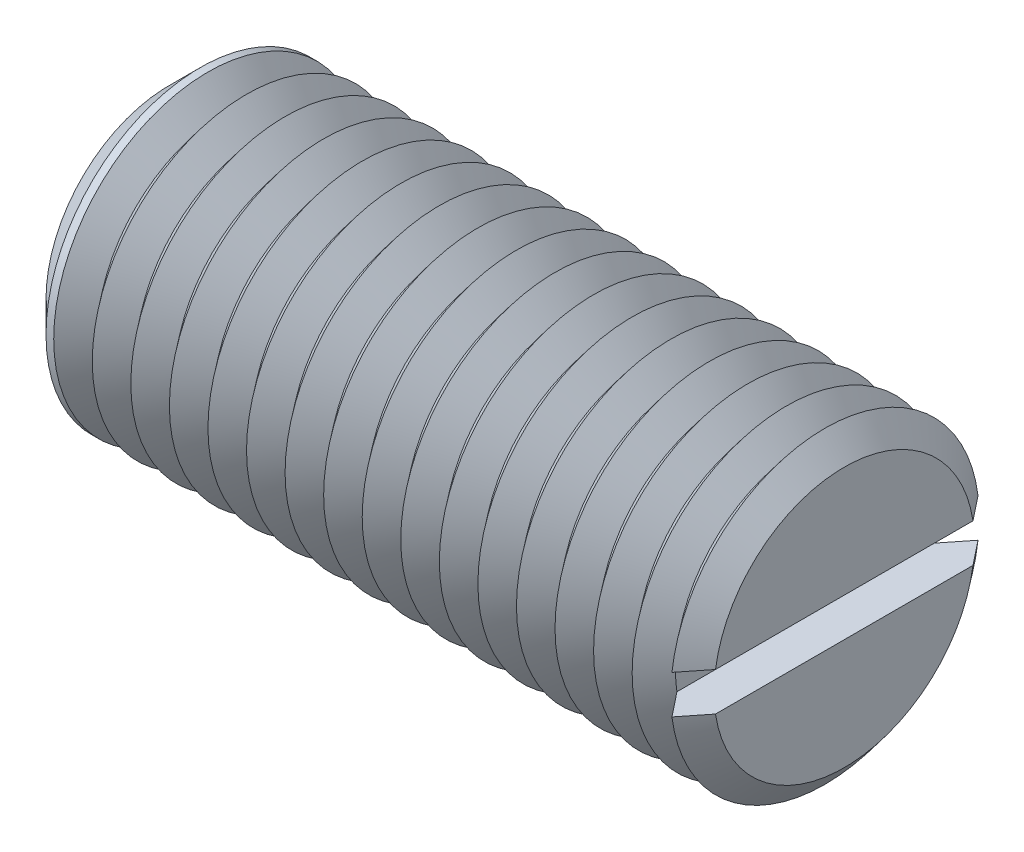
SolidWorks part; units mm, degrees
ref_plane "Front Plane" through (0, 0, 0) normal (0, 0, 1) x (1, 0, 0)
ref_plane "Top Plane" through (0, 0, 0) normal (0, 1, 0) x (1, 0, 0)
ref_plane "Right Plane" through (0, 0, 0) normal (1, 0, 0) x (0, 0, -1)
sketch "Sketch1" plane through (0, 0, 0) normal (1, 0, 0) x (0, 0, -1)
  circle A0 centre (0, 0) radius 8
  dimension "D1" = 16
extrude "Extrude1" add sketch "Sketch1" along normal mid plane 35
sketch "Sketch2" plane through (0, 0, 0) normal (0, 0, 1) x (1, 0, 0)
  line L0 (17.5, 1) -> (15.5, 1)
  line L1 (17.5, -8) -> (17.5, 8) construction
  line L2 (15.5, 1) -> (15.5, -1)
  line L3 (0, 0) -> (50000, 0) construction
  line L4 (17.5, -1) -> (15.5, -1)
  line L5 (17.5, -1) -> (17.5, 1)
  point P9 (15.5, 0)
  dimension "D1" = 2
extrude "Extrude2" cut sketch "Sketch2" against normal mid plane 24
chamfer "Chamfer1" distance 1.6 angle 45 1 edges at (-17.5, 0, -8)
sketch "Sketch3" plane through (0, 0, 0) normal (0, 0, 1) x (1, 0, 0)
  line L0 (0, 0) -> (30.9602, 0) construction
  line L1 (16.5, -8) -> (18.5, -8)
  line L2 (-15.9, -8) -> (17.5, -8) construction
  line L3 (18.5, -8) -> (17.5, -6.751)
  line L4 (17.5, -8) -> (17.5, -1) construction
  line L5 (17.5, -6.751) -> (16.5, -8)
  dimension "D1" = 2
  dimension "D2" = 1.6
revolve "Cut-Revolve1" cut sketch "Sketch3" angle 360 about L0
pattern_linear "LPattern1" count 17 spacing 2 along (-1, 0, 0) of "Cut-Revolve1"
equation "\"D2@Sketch3\" = \"D1@Sketch3\"*0.8"
